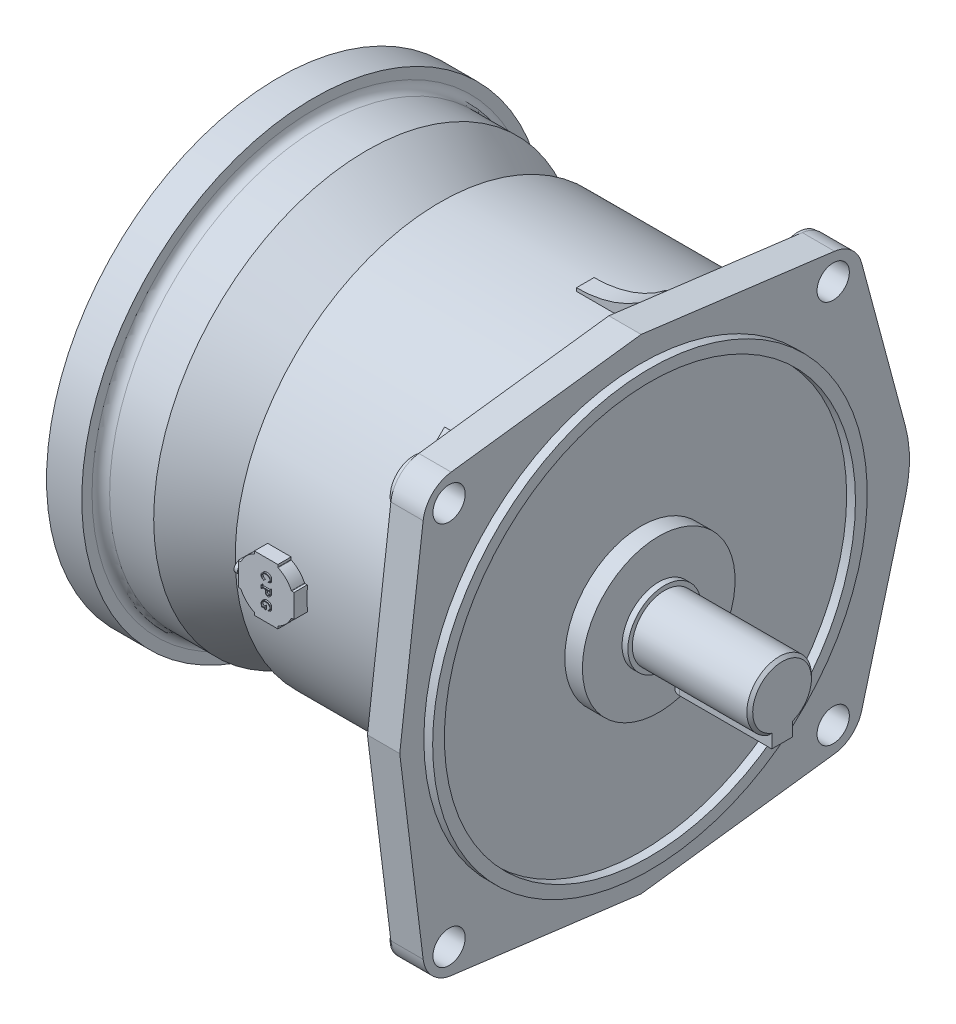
SolidWorks part; units mm, degrees
ref_plane "前视基准面" through (0, 0, 0) normal (0, 0, 1) x (1, 0, 0)
ref_plane "上视基准面" through (0, 0, 0) normal (0, 1, 0) x (1, 0, 0)
ref_plane "右视基准面" through (0, 0, 0) normal (1, 0, 0) x (0, 0, -1)
sketch "草图1" plane through (0, 0, 0) normal (0, 1, 0) x (1, 0, 0)
  line L0 (0, 0) -> (15.7361, 0) construction
  line L1 (0, 0) -> (0, -11)
  line L2 (0, -11) -> (-40, -11)
  line L3 (-40, -11) -> (-40, -12.5)
  line L4 (-40, -12.5) -> (-42, -12.5)
  line L5 (-45, -26) -> (-45, -74)
  line L6 (-45, -74) -> (-48, -74)
  line L7 (-48, -74) -> (-48, 0)
  line L8 (-48, 0) -> (0, 0)
  line L9 (-45, -26) -> (-42, -26)
  line L10 (-42, -26) -> (-42, -12.5)
  dimension "D1" = 40
  dimension "D2" = 22
  dimension "D3" = 25
  dimension "D4" = 3
  dimension "D5" = 148
  dimension "D6" = 48
  dimension "D7" = 3
  dimension "D8" = 52
revolve "旋转1" add sketch "草图1" angle 360 about L0
sketch "草图2" plane through (0, 0, 0) normal (0, 1, 0) x (1, 0, 0)
  line L0 (8.0167, 17.5) -> (-59, 17.5) construction
  line L1 (-48, 74) -> (-48, -74) construction
  line L4 (-59, 17.5) -> (-59, -52.25)
  line L5 (-59, -52.25) -> (-134, -52.25)
  line L6 (-134, -52.25) -> (-134, 17.5)
  line L11 (-59, 17.5) -> (-134, 17.5)
  dimension "D1" = 17.5
  dimension "D2" = 11
  dimension "D3" = 139.5
  dimension "D5" = 75
revolve "旋转2" add sketch "草图2" angle 360 about L0
sketch "草图12" plane through (-59, 0, 0) normal (1, 0, 0) x (0, 0, -1)
  line L0 (0, -82.5) -> (73.1856, -73.1856)
  line L1 (-73.1856, -73.1856) -> (0, -82.5)
  line L2 (-73.1856, -73.1856) -> (-82.2044, 0)
  line L3 (-73.1856, 73.1856) -> (0, 82.5)
  line L4 (73.1856, -73.1856) -> (92.7956, 0)
  line L5 (-82.2044, 0) -> (-73.1856, 73.1856)
  line L6 (0, 82.5) -> (73.1856, 73.1856)
  line L7 (92.7956, 0) -> (73.1856, 73.1856)
  line L8 (167.8979, 0) -> (-107.2143, 0) construction
  line L9 (0, 107.5085) -> (0, -103.3164) construction
  line L10 (0, 0) -> (-65.4074, 65.4074) construction
  line L11 (0, 0) -> (65.4074, 65.4074) construction
  circle A0 centre (0, 0) radius 92.5 construction
  circle A1 centre (-65.4074, 65.4074) radius 5.5
  circle A2 centre (65.4074, 65.4074) radius 5.5
  circle A3 centre (65.4074, -65.4074) radius 5.5
  circle A4 centre (-65.4074, -65.4074) radius 5.5
  dimension "D3" = 185
  dimension "D4" = 11
  dimension "D5" = 15
  dimension "D1" = 165
  dimension "D2" = 175
  dimension "D6" = 11
extrude "拉伸8" add sketch "草图12" along normal up to surface (11 mm away)
sketch "草图5" plane through (0, 0, 0) normal (0, 1, 0) x (1, 0, 0)
  line L0 (0, -3.5) -> (-31.5, -3.5)
  line L1 (0, -11) -> (0, 11) construction
  line L2 (-31.5, 3.5) -> (0, 3.5)
  line L3 (0, 3.5) -> (0, -3.5)
  line L4 (25, -13.7955) -> (25, 19.6443) construction
  arc A0 (-31.5, -3.5) -> (-31.5, 3.5) centre (-31.5, 0) cw
  dimension "D2" = 35
  dimension "D1" = 7
  dimension "D3" = 25
extrude "拉伸4" add sketch "草图5" against normal blind 14
fillet "圆角4" radius 11 4 edges at (-53.5, 73.1856, 73.1856) (-53.5, 73.1856, -73.1856) (-53.5, -73.1856, -73.1856) (-53.5, -73.1856, 73.1856)
fillet "圆角5" radius 40 1 edges at (-53.5, 0, -92.7956)
chamfer "倒角1" distance 1 angle 45 1 edges at (0, 11, 0)
sketch "草图18" plane through (-59, 0, 0) normal (-1, 0, 0) x (0, 0, 1)
  line L0 (-17.5, 0) -> (57.6613, -75.1613) construction
  line L1 (0, -73.7) -> (0, 73.7) construction
  line L2 (64.7028, -74.2652) -> (0, -82.5) construction
  line L3 (31.8207, -49.3207) -> (57.6613, -75.1613)
  line L4 (-17.5, 0) -> (-65.4074, -65.4074) construction
  line L5 (-64.4716, -63.2059) -> (-58.7151, -56.2705)
  line L7 (-17.5, 0) -> (-17.5, -80.2727) construction
  line L8 (0, -82.5) -> (-65.8603, -74.1178) construction
  line L9 (-17.5, -69.75) -> (-17.5, -80.2727)
  circle A0 centre (-17.5, 0) radius 69.75 construction
  arc A1 (-75.0967, -66.0529) -> (-65.8603, -74.1178) centre (-64.4716, -63.2059) ccw construction
  circle A3 centre (-17.5, 0) radius 69.75 construction
  dimension "D1" = 45
  dimension "D2" = 9.013
  dimension "D4" = 36.5442
  dimension "D5" = 10.5227
ref_plane "基准面7" through (-60, 0, 0) normal (1, 0, 0) x (0, 0, -1)
sketch "草图13" plane through (-59, 0, 0) normal (1, 0, 0) x (0, 0, -1)
  line L5 (0, 0) -> (107.7406, 0) construction
  circle A1 centre (65.4074, 65.4074) radius 8.6078
  circle A3 centre (65.4074, 65.4074) radius 5.5
  circle A4 centre (65.4074, -65.4074) radius 5.5 construction
  circle A5 centre (65.4074, -65.4074) radius 5.5
  circle A7 centre (-65.4074, -65.4074) radius 5.5
  arc A10 (65.8603, -74.1178) -> (75.0967, -66.0529) centre (64.4716, -63.2059) ccw construction
  circle A11 centre (-65.4074, -65.4074) radius 5.5 construction
  arc A12 (-74.2314, -64.6986) -> (-64.7028, -74.2652) centre (-63.314, -63.3532) ccw construction
  circle A14 centre (-65.4074, 65.4074) radius 5.5
  circle A15 centre (-65.4074, 65.4074) radius 8.0671
  circle A20 centre (-65.4074, -65.4074) radius 8.0671
  circle A21 centre (65.4074, -65.4074) radius 8.6078
  point P8 (17.5, 0)
extrude "拉伸9" add sketch "草图13" against normal up to surface (1 mm away)
sketch "草图14" plane through (0, 0, 0) normal (0, 1, 0) x (1, 0, 0)
  line L0 (-59, 17.5) -> (-134, 17.5) construction
  line L5 (-59, -64.7028) -> (-59, 0) construction
  line L6 (-84.5442, -52.25) -> (-84.5442, -53.25)
  line L7 (-59, -77.7942) -> (-60, -77.7942)
  line L9 (-59, -52.25) -> (-134, -52.25) construction
  arc A0 (-60, -77.7942) -> (-84.5442, -53.25) centre (-84.5442, -77.7942) ccw
  dimension "D1" = 95.2942
  dimension "D2" = 1
  dimension "D3" = 1
rib "筋17" sketch "草图14" sketch "草图14" thickness 6 extrusion direction parallel to sketch draft on no parameters "D1"=6
pattern_circular "阵列(圆周)16" count 8 over 360 about axis through (0, 0, -17.5) along (1, 0, 0) of "筋17"
ref_plane "基准面8" through (0, 0, -17.5) normal (0, 0, 1) x (1, 0, 0)
sketch "草图17" plane through (0, 0, -17.5) normal (0, 0, 1) x (1, 0, 0)
  line L0 (-59, -79.2727) -> (-60, -79.2727)
  line L1 (-59, -74.2652) -> (-59, -82.5) construction
  line L2 (-84.5442, -69.75) -> (-84.5442, -70.75)
  line L4 (-134, -69.75) -> (-59, -69.75) construction
  line L6 (-84.5442, -52.1491) -> (-84.5442, -47.9065) construction
  arc A0 (-60, -79.2727) -> (-84.5442, -70.75) centre (-84.5442, -110.3531) ccw
  dimension "D1" = 9.5227
  dimension "D2" = 1
  dimension "D3" = 1
rib "筋24" sketch "草图17" sketch "草图17" thickness 6 extrusion direction parallel to sketch draft on no parameters "D1"=6
mirror "镜向1" about plane through (0, 0, 0) normal (0, 1, 0) of "筋24"
sketch "草圖1" plane through (0, 0, 0) normal (0, 1, 0) x (1, 0, 0)
  line L0 (-134, 17.5) -> (-181.5, 17.5)
  line L1 (-134, -42.5) -> (-134, 17.5)
  line L2 (-37.3334, 17.5) -> (-209.5704, 17.5) construction
  line L4 (-134, -42.5) -> (-139, -42.5)
  line L5 (-139, -42.5) -> (-159, -55)
  line L6 (-159, -55) -> (-174, -55)
  line L7 (-177, -58) -> (-177, -61.5)
  line L8 (-177, -61.5) -> (-189, -61.5)
  line L9 (-189, -61.5) -> (-189, -38.5)
  line L10 (-188, -37.5) -> (-185, -37.5)
  line L11 (-185, -37.5) -> (-185, -32.5871)
  line L12 (-164, -22.0606) -> (-164, -16.5)
  line L13 (-167, -13.5) -> (-182, -13.5)
  line L14 (-183, -12.5) -> (-183, -3.5)
  line L15 (-183, -3.5) -> (-181.8, -3.5)
  line L16 (-181.5, -3.2) -> (-181.5, 17.5)
  line L17 (-184.9137, -32.488) -> (-164, -29.5869)
  arc A0 (-174, -55) -> (-177, -58) centre (-174, -58) ccw
  arc A1 (-164, -29.5869) -> (-162.7461, -24.5001) centre (-164.3875, -26.7934) ccw
  arc A2 (-188, -37.5) -> (-189, -38.5) centre (-188, -38.5) ccw
  arc A3 (-184.9137, -32.488) -> (-185, -32.5871) centre (-184.9, -32.5871) ccw
  arc A4 (-162.7461, -24.5001) -> (-164, -22.0606) centre (-161, -22.0606) cw
  arc A5 (-164, -16.5) -> (-167, -13.5) centre (-167, -16.5) ccw
  arc A6 (-182, -13.5) -> (-183, -12.5) centre (-182, -12.5) cw
  arc A7 (-181.8, -3.5) -> (-181.5, -3.2) centre (-181.8, -3.2) ccw
  point P27 (-189, -37.5)
  point P30 (-185, -32.5)
  point P33 (-164, -24)
  point P38 (-183, -13.5)
  point P41 (-183, -2.5)
  dimension "D9" = 158
  dimension "D19" = 17.5
  dimension "D20" = 189
  dimension "D2" = 120
  dimension "D3" = 134
  dimension "D7" = 55
  dimension "D8" = 145
  dimension "D10" = 110
revolve "旋轉1" add sketch "草圖1" angle 360 about L2
sketch "草圖2" plane through (-189, 0, 0) normal (-1, 0, 0) x (0, 0, 1)
  line L0 (-101.5945, 0) -> (71.3288, 0) construction
  line L1 (-17.5, 84.2191) -> (-17.5, -84.9666) construction
  circle A0 centre (-17.5, 0) radius 65 construction
  circle A1 centre (-63.4619, 45.9619) radius 4
  circle A2 centre (28.4619, 45.9619) radius 4
  circle A3 centre (28.4619, -45.9619) radius 4
  circle A4 centre (-63.4619, -45.9619) radius 4
  dimension "D1" = 130
  dimension "D2" = 8
extrude "伸長1" cut sketch "草圖2" against normal blind 25
sketch "草圖4" plane through (-189, 0, 0) normal (-1, 0, 0) x (0, 0, 1)
  line L0 (-17.5, 0) -> (-83.7638, 0) construction
  line L1 (-78.6334, 25.778) -> (-58.9295, 5.5251)
  line L2 (-78.6334, -25.2495) -> (-58.8656, -5.4747)
  line L3 (-57.9241, 10.7256) -> (-64.9952, 17.7967)
  line L4 (-35.2967, 47.4952) -> (-28.2256, 40.4241)
  line L5 (-64.2566, 35.0893) -> (-52.5893, 46.7566)
  line L6 (-43.278, 61.1334) -> (-23.5033, 41.3656)
  line L7 (7.7495, 61.1334) -> (-12.5034, 41.4295)
  line L8 (17.0607, 46.7566) -> (28.728, 35.0893)
  line L10 (29.4666, 17.7967) -> (22.3955, 10.7256)
  line L11 (43.1048, 25.778) -> (23.337, 6.0033)
  line L12 (43.1048, -25.2495) -> (23.4009, -4.9966)
  line L13 (28.728, -34.5607) -> (17.0607, -46.228)
  line L15 (-0.2319, -46.9666) -> (-7.303, -39.8955)
  line L16 (7.7495, -60.6048) -> (-12.0253, -40.837)
  line L17 (-43.278, -60.6048) -> (-23.0251, -40.9009)
  line L18 (-52.5893, -46.228) -> (-64.2566, -34.5607)
  line L20 (-64.9952, -17.2681) -> (-57.9241, -10.197)
  line L22 (-7.303, 40.4241) -> (-0.2319, 47.4952)
  line L24 (22.3955, -10.197) -> (29.4666, -17.2681)
  line L29 (-28.2256, -39.8955) -> (-35.2967, -46.9666)
  arc A0 (-78.6334, 25.778) -> (-78.6334, -25.2495) centre (-17.7643, 0.2643) ccw
  arc A1 (-28.2256, 40.4241) -> (-57.9241, 10.7256) centre (-17.7643, 0.2643) ccw
  arc A2 (22.3955, 10.7256) -> (-7.303, 40.4241) centre (-17.7643, 0.2643) ccw
  arc A3 (-58.9295, 5.5251) -> (-58.8656, -5.4747) centre (-17.7643, 0.2643) ccw
  arc A4 (7.7495, 61.1334) -> (-43.278, 61.1334) centre (-17.7643, 0.2643) ccw
  arc A5 (-12.5034, 41.4295) -> (-23.5033, 41.3656) centre (-17.7643, 0.2643) ccw
  arc A6 (-7.303, -39.8955) -> (22.3955, -10.197) centre (-17.7643, 0.2643) ccw
  arc A7 (43.1048, -25.2495) -> (43.1048, 25.778) centre (-17.7643, 0.2643) ccw
  arc A8 (23.4009, -4.9966) -> (23.337, 6.0033) centre (-17.7643, 0.2643) ccw
  arc A9 (-57.9241, -10.197) -> (-28.2256, -39.8955) centre (-17.7643, 0.2643) ccw
  arc A10 (-43.278, -60.6048) -> (7.7495, -60.6048) centre (-17.7643, 0.2643) ccw
  arc A11 (-23.0251, -40.9009) -> (-12.0253, -40.837) centre (-17.7643, 0.2643) ccw
  spline S0 degree 2 poles (-64.9952, 17.7967) (-69.8355, 26.6584) (-64.2566, 35.0893) knots 0 0 0 1 1 1
  spline S1 degree 2 poles (-35.2967, 47.4952) (-44.1584, 52.3355) (-52.5893, 46.7566) knots 0 0 0 1 1 1
  spline S2 degree 2 poles (29.4666, 17.7967) (34.307, 26.6584) (28.728, 35.0893) knots 0 0 0 1 1 1
  spline S3 degree 2 poles (-0.2319, 47.4952) (8.6298, 52.3355) (17.0607, 46.7566) knots 0 0 0 1 1 1
  spline S4 degree 2 poles (-0.2319, -46.9666) (8.6298, -51.807) (17.0607, -46.228) knots 0 0 0 1 1 1
  spline S5 degree 2 poles (29.4666, -17.2681) (34.307, -26.1298) (28.728, -34.5607) knots 0 0 0 1 1 1
  spline S6 degree 2 poles (-64.9952, -17.2681) (-69.8355, -26.1298) (-64.2566, -34.5607) knots 0 0 0 1 1 1
  spline S7 degree 2 poles (-35.2967, -46.9666) (-44.1584, -51.807) (-52.5893, -46.228) knots 0 0 0 1 1 1
extrude "伸長2" cut sketch "草圖4" against normal blind 39
sketch "草圖5" plane through (-150, 0, 0) normal (-1, 0, 0) x (0, 0, 1)
  circle A0 centre (-17.5, 0) radius 51.5 construction
  circle A1 centre (-53.916, 36.416) radius 3
  circle A2 centre (18.916, 36.416) radius 3
  circle A3 centre (18.916, -36.416) radius 3
  circle A4 centre (-53.916, -36.416) radius 3
  dimension "D1" = 103
  dimension "D2" = 6
extrude "伸長3" cut sketch "草圖5" against normal blind 11
sketch "草圖6" plane through (-181.5, 0, 0) normal (-1, 0, 0) x (0, 0, 1)
  line L0 (-17.5, -16.5253) -> (-17.5, 16) construction
  line L1 (-8.2, -2.5) -> (-8.2, 2.5)
  line L2 (-8.2, -2.5) -> (-10.9617, -2.5)
  line L3 (-35.2414, 0) -> (-0.9158, 0) construction
  line L4 (-8.2, 2.5) -> (-10.9617, 2.5)
  circle A0 centre (-17.5, 0) radius 12.5 construction
  arc A2 (-10.9617, 2.5) -> (-10.9617, -2.5) centre (-17.5, 0) ccw
  dimension "D1" = 25
  dimension "D2" = 5
  dimension "D5" = 14
  dimension "D4" = 9.3
extrude "伸長4" cut sketch "草圖6" against normal blind 28
sketch "草圖7" plane through (-181.5, 0, 0) normal (-1, 0, 0) x (0, 0, 1)
  line L0 (-8.2, -2.5) -> (-10.9617, -2.5) construction
  line L1 (-8.2, -2.5) -> (-8.2, 2.5) construction
  line L2 (-8.2, 2.5) -> (-10.9617, 2.5) construction
  line L3 (-8.2, -2.5) -> (-10.9617, -2.5)
  line L4 (-8.2, -2.5) -> (-8.2, 2.5)
  line L5 (-8.2, 2.5) -> (-10.9617, 2.5)
  circle A0 centre (-17.5, 0) radius 12.5 construction
  circle A1 centre (-17.5, 0) radius 12.5
  arc A2 (-10.9617, 2.5) -> (-10.9617, -2.5) centre (-17.5, 0) ccw construction
  arc A3 (-10.9617, 2.5) -> (-10.9617, -2.5) centre (-17.5, 0) ccw
extrude "伸長5" add sketch "草圖7" along normal blind 1
sketch "草圖8" plane through (-45, 0, 0) normal (1, 0, 0) x (0, 0, -1)
  circle A0 centre (0, 0) radius 26 construction
  circle A1 centre (0, 0) radius 26
  circle A2 centre (0, 0) radius 70
  dimension "D1" = 140
extrude "伸長6" cut sketch "草圖8" against normal blind 3
ref_plane "平面1" through (0, 0, 56.7) normal (0, 0, 1) x (1, 0, 0)
sketch "草圖9" plane through (0, 0, 56.7) normal (0, 0, 1) x (1, 0, 0)
  line L0 (-123, 9.5) -> (-115, 9.5)
  line L2 (-123, 8.7121) -> (-123, 9.5)
  line L3 (-115, 8.7121) -> (-115, 9.5)
  line L4 (-127.7121, 4) -> (-128.5, 4)
  line L5 (-127.7121, -4) -> (-128.5, -4)
  line L6 (-128.5, -4) -> (-128.5, 4)
  line L7 (-123, -8.7121) -> (-123, -9.5)
  line L8 (-115, -8.7121) -> (-115, -9.5)
  line L9 (-115, -9.5) -> (-123, -9.5)
  line L10 (-110.2879, -4) -> (-109.5, -4)
  line L11 (-110.2879, 4) -> (-109.5, 4)
  line L12 (-109.5, 4) -> (-109.5, -4)
  arc A0 (-123.0855, 8.5766) -> (-127.5766, 4.0855) centre (-119, 0) ccw
  arc A1 (-123.0855, 8.5766) -> (-123, 8.7121) centre (-123.15, 8.7121) ccw
  arc A2 (-115, 8.7121) -> (-114.9145, 8.5766) centre (-114.85, 8.7121) ccw
  arc A3 (-127.7121, 4) -> (-127.5766, 4.0855) centre (-127.7121, 4.15) ccw
  arc A4 (-127.5766, -4.0855) -> (-127.7121, -4) centre (-127.7121, -4.15) ccw
  arc A5 (-123, -8.7121) -> (-123.0855, -8.5766) centre (-123.15, -8.7121) ccw
  arc A6 (-114.9145, -8.5766) -> (-115, -8.7121) centre (-114.85, -8.7121) ccw
  arc A7 (-110.2879, -4) -> (-110.4234, -4.0855) centre (-110.2879, -4.15) ccw
  arc A8 (-110.4234, 4.0855) -> (-110.2879, 4) centre (-110.2879, 4.15) ccw
  arc A9 (-127.5766, -4.0855) -> (-123.0855, -8.5766) centre (-119, 0) ccw
  arc A10 (-114.9145, -8.5766) -> (-110.4234, -4.0855) centre (-119, 0) ccw
  arc A11 (-110.4234, 4.0855) -> (-114.9145, 8.5766) centre (-119, 0) ccw
extrude "伸長7" add sketch "草圖9" against normal blind 4.5
sketch "草圖10"
extrude "伸長8" add sketch "草圖10" along normal blind 0.5
sketch "草圖11" plane through (0, 0, 0) normal (0, 1, 0) x (1, 0, 0)
  line L0 (-127.7177, -53.4307) -> (-124.0482, -53.6345)
  line L1 (-129.3486, -53.4307) -> (-127.7177, -53.4307)
  line L2 (-129.3486, -53.4307) -> (-129.3486, -52.8191)
  line L3 (-130.5718, -52.8191) -> (-129.3486, -52.8191)
  line L4 (-124.0482, -54.45) -> (-124.0482, -53.6345)
  line L5 (-124.0482, -54.45) -> (-130.5718, -54.45)
  line L6 (-130.5718, -52.8191) -> (-130.5718, -54.45)
revolve "旋轉2" add sketch "草圖11" angle 360 about L5
equation "\"D5@草图1\" = \"D1@草圖8\"+8"
equation "\"D3@草图1\" = \"D2@草图1\"+3"
equation "\"D1@拉伸4\" = \"D3@草图5\"-\"D2@草图1\"/2"
equation "\"D7@草圖1\" = \"D20@草圖1\"-\"D3@草圖1\""
